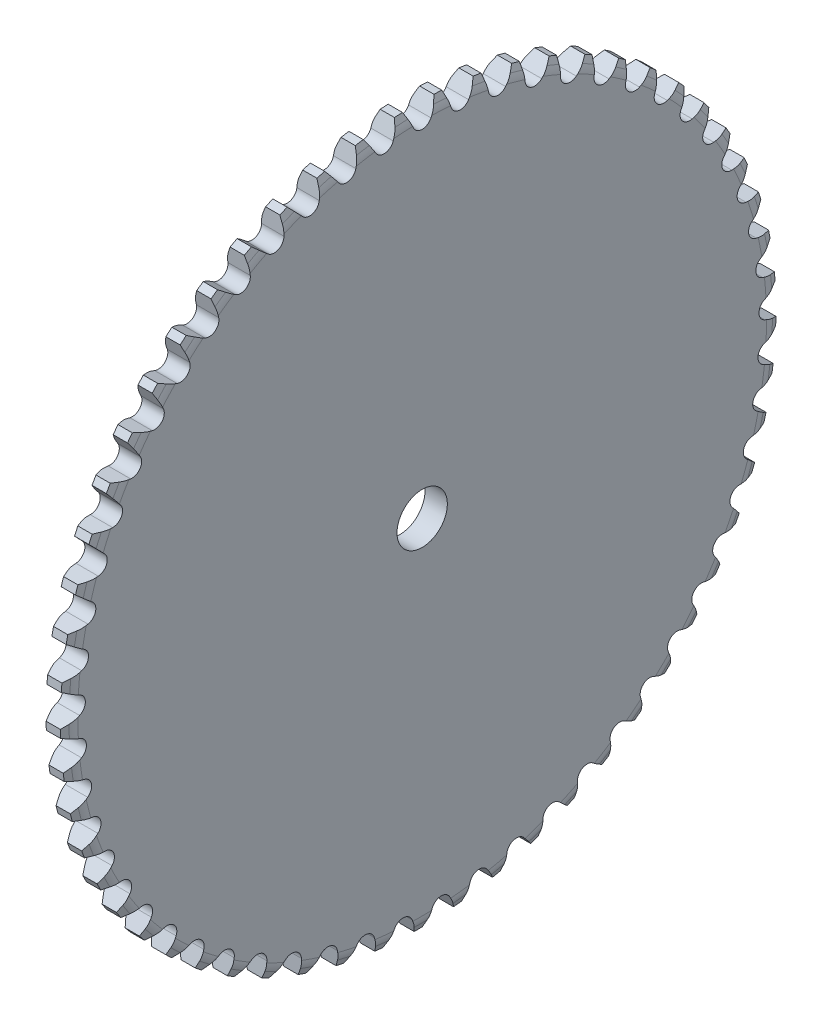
SolidWorks part; units mm, degrees
ref_plane "Plan de face" through (0, 0, 0) normal (0, 0, 1) x (1, 0, 0)
ref_plane "Plan de dessus" through (0, 0, 0) normal (0, 1, 0) x (1, 0, 0)
ref_plane "Plan de droite" through (0, 0, 0) normal (1, 0, 0) x (0, 0, -1)
sketch "Esquisse1" plane through (0, 0, 0) normal (0, 0, 1) x (1, 0, 0)
  line L0 (0, 12.5) -> (11.1, 12.5)
  line L1 (11.1, 12.5) -> (11.1, 171.0032)
  line L2 (10.3679, 174.6603) -> (9.1, 177.7)
  line L3 (9.1, 177.7) -> (2, 177.7)
  line L4 (2, 177.7) -> (0.7321, 174.6603)
  line L5 (0, 171.0032) -> (0, 12.5)
  line L6 (11.1, 0) -> (0, 0) construction
  arc A0 (11.1, 171.0032) -> (10.3679, 174.6603) centre (1.6, 171.0032) ccw
  arc A1 (0.7321, 174.6603) -> (0, 171.0032) centre (9.5, 171.0032) ccw
revolve "Révolution1" add sketch "Esquisse1" angle 360 about L6
ref_plane "Plan1" through (5.55, 0, 0) normal (1, 0, 0) x (0, 0, -1)
sketch "Esquisse2" plane through (5.55, 0, 0) normal (1, 0, 0) x (0, 0, -1)
  line L0 (-177.6761, -2.9128) -> (-177.5668, -6.8795)
  line L1 (-177.5668, -6.8795) -> (-169.8828, -9.7162)
  line L2 (-169.165, -18.3781) -> (-176.2773, -22.4409)
  line L3 (-176.2773, -22.4409) -> (-175.7323, -26.3715)
  line L4 (-175.7323, -26.3715) -> (-167.7828, -28.3458)
  line L5 (-166.1166, -36.8761) -> (-172.7388, -41.6967)
  line L6 (-172.7388, -41.6967) -> (-171.7646, -45.5434)
  line L7 (-171.7646, -45.5434) -> (-163.6462, -46.6312)
  line L8 (-161.0517, -54.9264) -> (-167.1034, -60.4463)
  line L9 (-167.1034, -60.4463) -> (-165.712, -64.1625)
  line L10 (-165.712, -64.1625) -> (-157.5232, -64.3506)
  line L11 (-154.0318, -72.3101) -> (-159.4396, -78.4622)
  line L12 (-159.4396, -78.4622) -> (-157.6478, -82.0028)
  line L13 (-157.6478, -82.0028) -> (-149.488, -81.2889)
  line L14 (-145.1423, -88.816) -> (-149.8404, -95.5256)
  line L15 (-149.8404, -95.5256) -> (-147.67, -98.8477)
  line L16 (-147.67, -98.8477) -> (-139.6383, -97.2405)
  line L17 (-134.4909, -104.2438) -> (-138.4224, -111.4295)
  line L18 (-138.4224, -111.4295) -> (-135.8997, -114.4926)
  line L19 (-135.8997, -114.4926) -> (-128.0935, -112.0116)
  line L20 (-122.2069, -118.4062) -> (-125.3241, -125.9808)
  line L21 (-125.3241, -125.9808) -> (-122.4797, -128.7478)
  line L22 (-122.4797, -128.7478) -> (-114.9939, -125.4231)
  line L23 (-108.4396, -131.1313) -> (-110.7045, -139.0029)
  line L24 (-110.7045, -139.0029) -> (-107.5731, -141.4402)
  line L25 (-107.5731, -141.4402) -> (-100.4984, -137.3122)
  line L26 (-93.3559, -142.2647) -> (-94.7412, -150.3376)
  line L27 (-94.7412, -150.3376) -> (-91.3606, -152.4157)
  line L28 (-91.3606, -152.4157) -> (-84.7829, -147.5344)
  line L29 (-77.139, -151.6711) -> (-77.6278, -159.8475)
  line L30 (-77.6278, -159.8475) -> (-74.0391, -161.541)
  line L31 (-74.0391, -161.541) -> (-68.0384, -155.9658)
  line L32 (-59.9858, -159.2365) -> (-59.5721, -167.417)
  line L33 (-59.5721, -167.417) -> (-55.8189, -168.7055)
  line L34 (-55.8189, -168.7055) -> (-50.4679, -162.504)
  line L35 (-42.1044, -164.869) -> (-40.7933, -172.9543)
  line L36 (-40.7933, -172.9543) -> (-36.9211, -173.8221)
  line L37 (-36.9211, -173.8221) -> (-32.2848, -167.0696)
  line L38 (-23.7119, -168.5002) -> (-21.5193, -176.3922)
  line L39 (-21.5193, -176.3922) -> (-17.5752, -176.8287)
  line L40 (-17.5752, -176.8287) -> (-13.7098, -169.6072)
  line L41 (-5.0315, -170.086) -> (-1.9841, -177.6889)
  line L42 (-1.9841, -177.6889) -> (1.9841, -177.6889)
  line L43 (1.9841, -177.6889) -> (5.0315, -170.086)
  line L44 (13.7098, -169.6072) -> (17.5752, -176.8287)
  line L45 (17.5752, -176.8287) -> (21.5193, -176.3922)
  line L46 (21.5193, -176.3922) -> (23.7119, -168.5002)
  line L47 (32.2848, -167.0696) -> (36.9211, -173.8221)
  line L48 (36.9211, -173.8221) -> (40.7933, -172.9543)
  line L49 (40.7933, -172.9543) -> (42.1044, -164.869)
  line L50 (50.4679, -162.504) -> (55.8189, -168.7055)
  line L51 (55.8189, -168.7055) -> (59.5721, -167.417)
  line L52 (59.5721, -167.417) -> (59.9858, -159.2365)
  line L53 (68.0384, -155.9658) -> (74.0391, -161.541)
  line L54 (74.0391, -161.541) -> (77.6278, -159.8475)
  line L55 (77.6278, -159.8475) -> (77.139, -151.6711)
  line L56 (84.7829, -147.5344) -> (91.3606, -152.4157)
  line L57 (91.3606, -152.4157) -> (94.7412, -150.3376)
  line L58 (94.7412, -150.3376) -> (93.3559, -142.2647)
  line L59 (100.4984, -137.3122) -> (107.5731, -141.4402)
  line L60 (107.5731, -141.4402) -> (110.7045, -139.0029)
  line L61 (110.7045, -139.0029) -> (108.4396, -131.1313)
  line L62 (114.9939, -125.4231) -> (122.4797, -128.7478)
  line L63 (122.4797, -128.7478) -> (125.3241, -125.9808)
  line L64 (125.3241, -125.9808) -> (122.2069, -118.4062)
  line L65 (128.0935, -112.0116) -> (135.8997, -114.4926)
  line L66 (135.8997, -114.4926) -> (138.4224, -111.4295)
  line L67 (138.4224, -111.4295) -> (134.4909, -104.2438)
  line L68 (139.6383, -97.2405) -> (147.67, -98.8477)
  line L69 (147.67, -98.8477) -> (149.8404, -95.5256)
  line L70 (149.8404, -95.5256) -> (145.1423, -88.816)
  line L71 (149.488, -81.2889) -> (157.6478, -82.0028)
  line L72 (157.6478, -82.0028) -> (159.4396, -78.4622)
  line L73 (159.4396, -78.4622) -> (154.0318, -72.3101)
  line L74 (157.5232, -64.3506) -> (165.712, -64.1625)
  line L75 (165.712, -64.1625) -> (167.1034, -60.4463)
  line L76 (167.1034, -60.4463) -> (161.0517, -54.9264)
  line L77 (163.6462, -46.6312) -> (171.7646, -45.5434)
  line L78 (171.7646, -45.5434) -> (172.7388, -41.6967)
  line L79 (172.7388, -41.6967) -> (166.1166, -36.8761)
  line L80 (167.7828, -28.3458) -> (175.7323, -26.3715)
  line L81 (175.7323, -26.3715) -> (176.2773, -22.4409)
  line L82 (176.2773, -22.4409) -> (169.165, -18.3781)
  line L83 (169.8828, -9.7162) -> (177.5668, -6.8795)
  line L84 (177.5668, -6.8795) -> (177.6761, -2.9128)
  line L85 (177.6761, -2.9128) -> (170.16, 0.343)
  line L86 (169.9205, 9.0312) -> (177.2459, 12.6961)
  line L87 (177.2459, 12.6961) -> (176.9182, 16.6508)
  line L88 (176.9182, 16.6508) -> (169.0895, 19.06)
  line L89 (167.8957, 27.6691) -> (174.7734, 32.1176)
  line L90 (174.7734, 32.1176) -> (174.0127, 36.0122)
  line L91 (174.0127, 36.0122) -> (165.9665, 37.5455)
  line L92 (163.8329, 45.971) -> (170.1795, 51.1491)
  line L93 (170.1795, 51.1491) -> (168.9949, 54.9364)
  line L94 (168.9949, 54.9364) -> (160.8289, 55.5753)
  line L95 (157.7813, 63.715) -> (163.5198, 69.5598)
  line L96 (163.5198, 69.5598) -> (161.9258, 73.1938)
  line L97 (161.9258, 73.1938) -> (153.739, 72.9305)
  line L98 (149.8145, 80.6855) -> (154.8752, 87.1262)
  line L99 (154.8752, 87.1262) -> (152.8911, 90.5627)
  line L100 (152.8911, 90.5627) -> (144.783, 89.4004)
  line L101 (140.0292, 96.6767) -> (144.3506, 103.6349)
  line L102 (144.3506, 103.6349) -> (142.0005, 106.8324)
  line L103 (142.0005, 106.8324) -> (134.0695, 104.7852)
  line L104 (128.5441, 111.4943) -> (132.0738, 118.8857)
  line L105 (132.0738, 118.8857) -> (129.3862, 121.8052)
  line L106 (129.3862, 121.8052) -> (121.7285, 118.8979)
  line L107 (115.4986, 124.9585) -> (118.1938, 132.6933)
  line L108 (118.1938, 132.6933) -> (115.2013, 135.2995)
  line L109 (115.2013, 135.2995) -> (107.91, 131.5674)
  line L110 (101.0512, 136.9059) -> (102.8791, 144.8903)
  line L111 (102.8791, 144.8903) -> (99.6181, 147.1514)
  line L112 (99.6181, 147.1514) -> (92.7815, 142.6399)
  line L113 (85.3771, 147.1914) -> (86.3155, 155.3284)
  line L114 (86.3155, 155.3284) -> (82.8256, 157.2171)
  line L115 (82.8256, 157.2171) -> (76.5269, 151.9809)
  line L116 (68.6666, 155.6902) -> (68.7043, 163.8811)
  line L117 (68.7043, 163.8811) -> (65.0277, 165.3744)
  line L118 (65.0277, 165.3744) -> (59.3432, 159.4771)
  line L119 (51.1227, 162.2992) -> (50.259, 170.4445)
  line L120 (50.259, 170.4445) -> (46.4405, 171.5242)
  line L121 (46.4405, 171.5242) -> (41.4393, 165.0374)
  line L122 (32.9582, 166.9381) -> (31.2037, 174.9389)
  line L123 (31.2037, 174.9389) -> (27.2896, 175.5921)
  line L124 (27.2896, 175.5921) -> (23.0323, 168.5944)
  line L125 (14.3936, 169.5505) -> (11.7696, 177.3098)
  line L126 (11.7696, 177.3098) -> (7.8074, 177.5284)
  line L127 (7.8074, 177.5284) -> (4.3457, 170.1049)
  line L128 (-4.3457, 170.1049) -> (-7.8074, 177.5284)
  line L129 (-7.8074, 177.5284) -> (-11.7696, 177.3098)
  line L130 (-11.7696, 177.3098) -> (-14.3936, 169.5505)
  line L131 (-23.0323, 168.5944) -> (-27.2896, 175.5921)
  line L132 (-27.2896, 175.5921) -> (-31.2037, 174.9389)
  line L133 (-31.2037, 174.9389) -> (-32.9582, 166.9381)
  line L134 (-41.4393, 165.0374) -> (-46.4405, 171.5242)
  line L135 (-46.4405, 171.5242) -> (-50.259, 170.4445)
  line L136 (-50.259, 170.4445) -> (-51.1227, 162.2992)
  line L137 (-59.3432, 159.4771) -> (-65.0277, 165.3744)
  line L138 (-65.0277, 165.3744) -> (-68.7043, 163.8811)
  line L139 (-68.7043, 163.8811) -> (-68.6666, 155.6902)
  line L140 (-76.5269, 151.9809) -> (-82.8256, 157.2171)
  line L141 (-82.8256, 157.2171) -> (-86.3155, 155.3284)
  line L142 (-86.3155, 155.3284) -> (-85.3771, 147.1914)
  line L143 (-92.7815, 142.6399) -> (-99.6181, 147.1514)
  line L144 (-99.6181, 147.1514) -> (-102.8791, 144.8903)
  line L145 (-102.8791, 144.8903) -> (-101.0512, 136.9059)
  line L146 (-107.91, 131.5674) -> (-115.2013, 135.2995)
  line L147 (-115.2013, 135.2995) -> (-118.1938, 132.6933)
  line L148 (-118.1938, 132.6933) -> (-115.4986, 124.9585)
  line L149 (-121.7285, 118.8979) -> (-129.3862, 121.8052)
  line L150 (-129.3862, 121.8052) -> (-132.0738, 118.8857)
  line L151 (-132.0738, 118.8857) -> (-128.5441, 111.4943)
  line L152 (-134.0695, 104.7852) -> (-142.0005, 106.8324)
  line L153 (-142.0005, 106.8324) -> (-144.3506, 103.6349)
  line L154 (-144.3506, 103.6349) -> (-140.0292, 96.6767)
  line L155 (-144.783, 89.4004) -> (-152.8911, 90.5627)
  line L156 (-152.8911, 90.5627) -> (-154.8752, 87.1262)
  line L157 (-154.8752, 87.1262) -> (-149.8145, 80.6855)
  line L158 (-153.739, 72.9305) -> (-161.9258, 73.1938)
  line L159 (-161.9258, 73.1938) -> (-163.5198, 69.5598)
  line L160 (-163.5198, 69.5598) -> (-157.7813, 63.715)
  line L161 (-160.8289, 55.5753) -> (-168.9949, 54.9364)
  line L162 (-168.9949, 54.9364) -> (-170.1795, 51.1491)
  line L163 (-170.1795, 51.1491) -> (-163.8329, 45.971)
  line L164 (-165.9665, 37.5455) -> (-174.0127, 36.0122)
  line L165 (-174.0127, 36.0122) -> (-174.7734, 32.1176)
  line L166 (-174.7734, 32.1176) -> (-167.8957, 27.6691)
  line L167 (-169.0895, 19.06) -> (-176.9182, 16.6508)
  line L168 (-176.9182, 16.6508) -> (-177.2459, 12.6961)
  line L169 (-177.2459, 12.6961) -> (-169.9205, 9.0312)
  line L170 (-170.16, 0.343) -> (-177.6761, -2.9128)
  circle A0 centre (0, 0) radius 266.55
  arc A1 (-169.8828, -9.7162) -> (-169.165, -18.3781) centre (-171.5434, -14.2145) cw
  arc A2 (-167.7828, -28.3458) -> (-166.1166, -36.8761) centre (-168.9386, -32.9994) cw
  arc A3 (-163.6462, -46.6312) -> (-161.0517, -54.9264) centre (-164.283, -51.3838) cw
  arc A4 (-157.5232, -64.3506) -> (-154.0318, -72.3101) centre (-157.6333, -69.1444) cw
  arc A5 (-149.488, -81.2889) -> (-145.1423, -88.816) centre (-149.0701, -86.0657) cw
  arc A6 (-139.6383, -97.2405) -> (-134.4909, -104.2438) centre (-138.6974, -101.9422) cw
  arc A7 (-128.0935, -112.0116) -> (-122.2069, -118.4062) centre (-126.6411, -116.5814) cw
  arc A8 (-114.9939, -125.4231) -> (-108.4396, -131.1313) centre (-113.0476, -129.8054) cw
  arc A9 (-100.4984, -137.3122) -> (-93.3559, -142.2647) centre (-98.0818, -141.4537) cw
  arc A10 (-84.7829, -147.5344) -> (-77.139, -151.6711) centre (-81.9255, -151.385) cw
  arc A11 (-68.0384, -155.9658) -> (-59.9858, -159.2365) centre (-64.7746, -159.4787) cw
  arc A12 (-50.4679, -162.504) -> (-42.1044, -164.869) centre (-46.8375, -165.6365) cw
  arc A13 (-32.2848, -167.0696) -> (-23.7119, -168.5002) centre (-28.3319, -169.7837) cw
  arc A14 (-13.7098, -169.6072) -> (-5.0315, -170.086) centre (-9.4823, -171.87) cw
  arc A15 (5.0315, -170.086) -> (13.7098, -169.6072) centre (9.4823, -171.87) cw
  arc A16 (23.7119, -168.5002) -> (32.2848, -167.0696) centre (28.3319, -169.7837) cw
  arc A17 (42.1044, -164.869) -> (50.4679, -162.504) centre (46.8375, -165.6365) cw
  arc A18 (59.9858, -159.2365) -> (68.0384, -155.9658) centre (64.7746, -159.4787) cw
  arc A19 (77.139, -151.6711) -> (84.7829, -147.5344) centre (81.9255, -151.385) cw
  arc A20 (93.3559, -142.2647) -> (100.4984, -137.3122) centre (98.0818, -141.4537) cw
  arc A21 (108.4396, -131.1313) -> (114.9939, -125.4231) centre (113.0476, -129.8054) cw
  arc A22 (122.2069, -118.4062) -> (128.0935, -112.0116) centre (126.6411, -116.5814) cw
  arc A23 (134.4909, -104.2438) -> (139.6383, -97.2405) centre (138.6974, -101.9422) cw
  arc A24 (145.1423, -88.816) -> (149.488, -81.2889) centre (149.0701, -86.0657) cw
  arc A25 (154.0318, -72.3101) -> (157.5232, -64.3506) centre (157.6333, -69.1444) cw
  arc A26 (161.0517, -54.9264) -> (163.6462, -46.6312) centre (164.283, -51.3838) cw
  arc A27 (166.1166, -36.8761) -> (167.7828, -28.3458) centre (168.9386, -32.9994) cw
  arc A28 (169.165, -18.3781) -> (169.8828, -9.7162) centre (171.5434, -14.2145) cw
  arc A29 (170.16, 0.343) -> (169.9205, 9.0312) centre (172.066, 4.743) cw
  arc A30 (169.0895, 19.06) -> (167.8957, 27.6691) centre (170.4999, 23.6429) cw
  arc A31 (165.9665, 37.5455) -> (163.8329, 45.971) centre (166.8642, 42.2557) cw
  arc A32 (160.8289, 55.5753) -> (157.7813, 63.715) centre (161.2029, 60.3557) cw
  arc A33 (153.739, 72.9305) -> (149.8145, 80.6855) centre (153.5849, 77.723) cw
  arc A34 (144.783, 89.4004) -> (140.0292, 96.6767) centre (144.1026, 94.1469) cw
  arc A35 (134.0695, 104.7852) -> (128.5441, 111.4943) centre (132.871, 109.428) cw
  arc A36 (121.7285, 118.8979) -> (115.4986, 124.9585) centre (120.0266, 123.3807) cw
  arc A37 (107.91, 131.5674) -> (101.0512, 136.9059) centre (105.7253, 135.8358) cw
  arc A38 (92.7815, 142.6399) -> (85.3771, 147.1914) centre (90.1405, 146.642) cw
  arc A39 (76.5269, 151.9809) -> (68.6666, 155.6902) centre (73.4616, 155.6682) cw
  arc A40 (59.3432, 159.4771) -> (51.1227, 162.2992) centre (55.891, 162.8048) cw
  arc A41 (41.4393, 165.0374) -> (32.9582, 166.9381) centre (37.6419, 167.9651) cw
  arc A42 (23.0323, 168.5944) -> (14.3936, 169.5505) centre (18.9359, 171.0866) cw
  arc A43 (4.3457, 170.1049) -> (-4.3457, 170.1049) centre (0, 172.1313) cw
  arc A44 (-14.3936, 169.5505) -> (-23.0323, 168.5944) centre (-18.9359, 171.0866) cw
  arc A45 (-32.9582, 166.9381) -> (-41.4393, 165.0374) centre (-37.6419, 167.9651) cw
  arc A46 (-51.1227, 162.2992) -> (-59.3432, 159.4771) centre (-55.891, 162.8048) cw
  arc A47 (-68.6666, 155.6902) -> (-76.5269, 151.9809) centre (-73.4616, 155.6682) cw
  arc A48 (-85.3771, 147.1914) -> (-92.7815, 142.6399) centre (-90.1405, 146.642) cw
  arc A49 (-101.0512, 136.9059) -> (-107.91, 131.5674) centre (-105.7253, 135.8358) cw
  arc A50 (-115.4986, 124.9585) -> (-121.7285, 118.8979) centre (-120.0266, 123.3807) cw
  arc A51 (-128.5441, 111.4943) -> (-134.0695, 104.7852) centre (-132.871, 109.428) cw
  arc A52 (-140.0292, 96.6767) -> (-144.783, 89.4004) centre (-144.1026, 94.1469) cw
  arc A53 (-149.8145, 80.6855) -> (-153.739, 72.9305) centre (-153.5849, 77.723) cw
  arc A54 (-157.7813, 63.715) -> (-160.8289, 55.5753) centre (-161.2029, 60.3557) cw
  arc A55 (-163.8329, 45.971) -> (-165.9665, 37.5455) centre (-166.8642, 42.2557) cw
  arc A56 (-167.8957, 27.6691) -> (-169.0895, 19.06) centre (-170.4999, 23.6429) cw
  arc A57 (-169.9205, 9.0312) -> (-170.16, 0.343) centre (-172.066, 4.743) cw
extrude "Enlèv. mat.-Extru.1" cut sketch "Esquisse2" along normal blind 11.1 and the other way blind 11.1
ref_plane "Plan2" through (0, 0, 0) normal (0, 0, 1) x (1, 0, 0)
ref_plane "Plan3" through (0, 0, 0) normal (0, 1, 0) x (-1, 0, 0)
